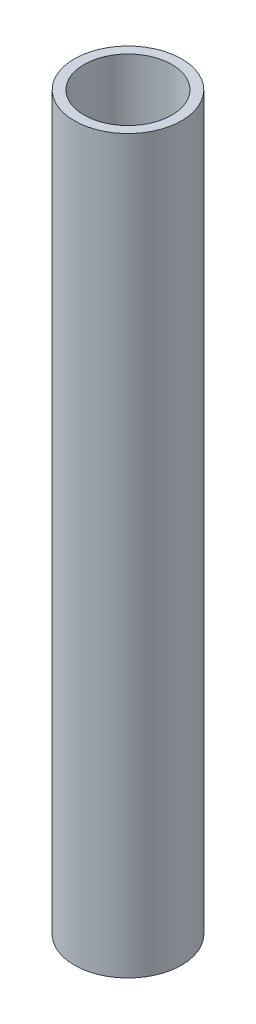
SolidWorks part; units mm, degrees
ref_plane "Plan1" through (0, 0, 0) normal (0, 0, 1) x (1, 0, 0)
ref_plane "Plan2" through (0, 0, 0) normal (0, 1, 0) x (1, 0, 0)
ref_plane "Plan3" through (0, 0, 0) normal (1, 0, 0) x (0, 0, -1)
sketch "Esquisse1" plane through (0, 0, 0) normal (0, 0, 1) x (1, 0, 0)
  line L0 (0, 0) -> (0, -88) construction
  line L2 (9, -24) -> (11, -24)
  line L3 (9, -24) -> (9, -174)
  line L4 (9, -174) -> (11, -174)
  line L5 (11, -24) -> (11, -174)
  dimension "D1" = 150
revolve "Base-Révolution" add sketch "Esquisse1" angle 360 about L0
